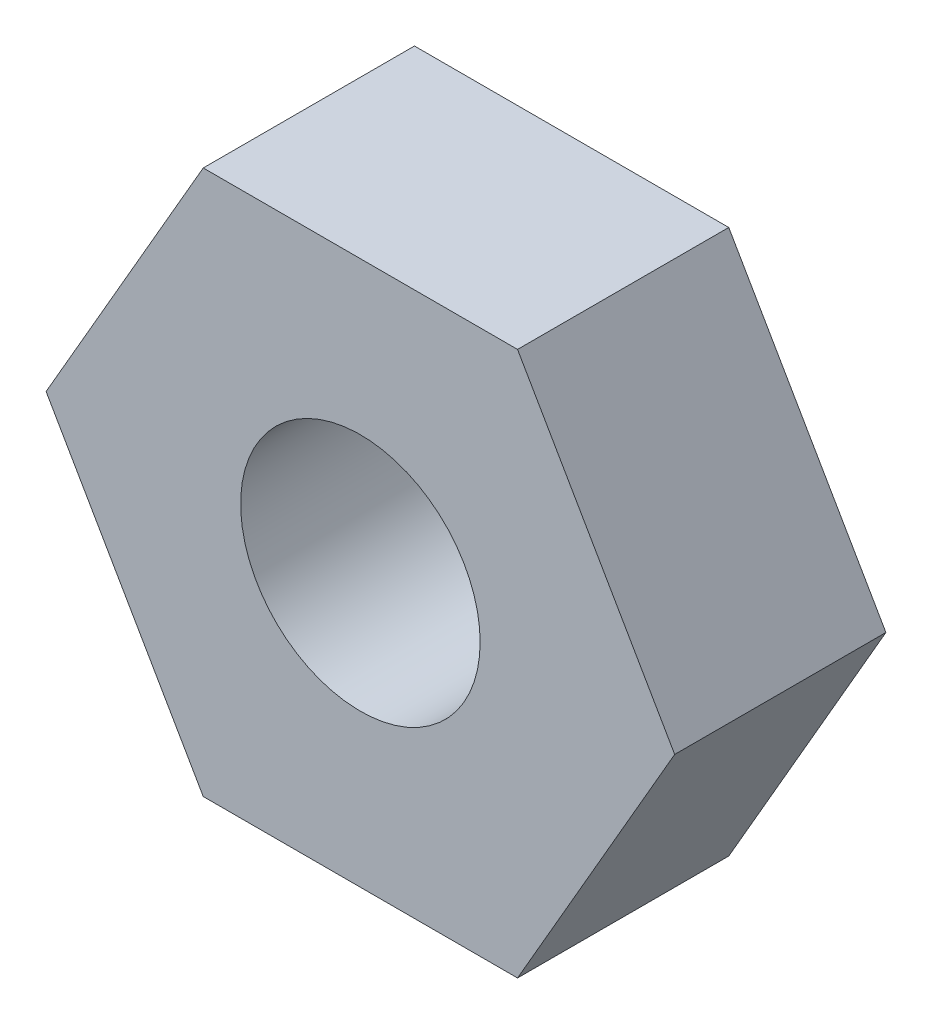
SolidWorks part; units mm, degrees
ref_plane "Front Plane" through (0, 0, 0) normal (0, 0, 1) x (1, 0, 0)
ref_plane "Top Plane" through (0, 0, 0) normal (0, 1, 0) x (1, 0, 0)
ref_plane "Right Plane" through (0, 0, 0) normal (1, 0, 0) x (0, 0, -1)
sketch "Sketch1" plane through (0, 0, 0) normal (0, 0, 1) x (1, 0, 0)
  line L1 (3.6662, 0) -> (1.8331, 3.175)
  line L2 (1.8331, 3.175) -> (-1.8331, 3.175)
  line L3 (-1.8331, 3.175) -> (-3.6662, 0)
  line L4 (-3.6662, 0) -> (-1.8331, -3.175)
  line L5 (-1.8331, -3.175) -> (1.8331, -3.175)
  line L6 (1.8331, -3.175) -> (3.6662, 0)
  circle A0 centre (0, 0) radius 3.175 construction
  dimension "D1" = 6.35
extrude "Boss-Extrude1" add sketch "Sketch1" along normal blind 2.4638
sketch "Sketch2" plane through (0, 0, 2.4638) normal (0, 0, 1) x (1, 0, 0)
  circle A0 centre (0, 0) radius 1.397
  dimension "D1" = 2.794
extrude "Cut-Extrude1" cut sketch "Sketch2" against normal through all
